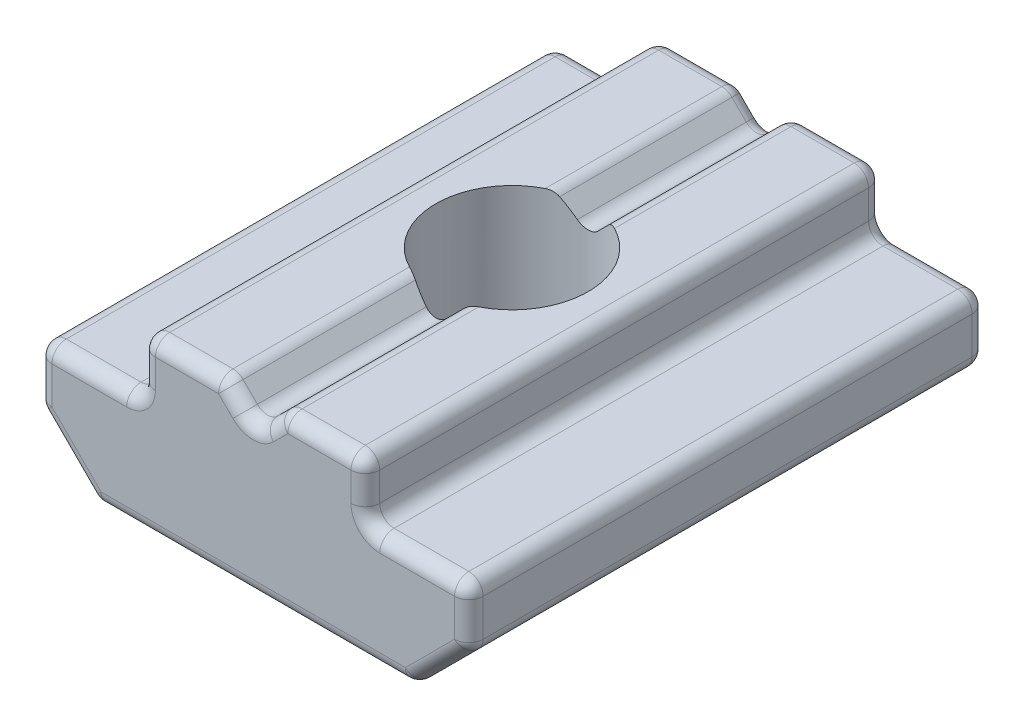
SolidWorks part; units mm, degrees
ref_plane "Спереди" through (0, 0, 0) normal (0, 0, 1) x (1, 0, 0)
ref_plane "Сверху" through (0, 0, 0) normal (0, 1, 0) x (1, 0, 0)
ref_plane "Справа" through (0, 0, 0) normal (1, 0, 0) x (0, 0, -1)
sketch "Эскиз1" plane through (0, 0, 0) normal (0, 0, 1) x (1, 0, 0)
  line L0 (-7.5, 1) -> (-7.5, -1)
  line L1 (-7.5, -1) -> (-5.5, -3)
  line L2 (-5.5, -3) -> (5.5, -3)
  line L3 (5.5, -3) -> (7.5, -1)
  line L4 (7.5, -1) -> (7.5, 1)
  line L5 (3.9, 1) -> (7.5, 1)
  line L6 (3.9, 1) -> (3.9, 3)
  line L7 (3.9, 3) -> (0.997, 3)
  line L8 (-3.9, 3) -> (-3.9, 1)
  line L9 (-3.9, 1) -> (-7.5, 1)
  line L10 (0, 3) -> (0, -3) construction
  line L11 (-7.5, 0) -> (7.5, 0) construction
  line L12 (-0.997, 3) -> (0, 2.003)
  line L13 (0.997, 3) -> (0, 2.003)
  line L14 (-0.997, 3) -> (-3.9, 3)
  dimension "D1" = 7.8
  dimension "D2" = 11
  dimension "D3" = 6
  dimension "D4" = 15
  dimension "D5" = 2
  dimension "D6" = 3.6
  dimension "D8" = 135
  dimension "D9" = 1.41
  dimension "D10" = 135
extrude "Бобышка-Вытянуть1" add sketch "Эскиз1" along normal blind 18
fillet "Скругление1" radius 0.5 39 edges at (-6.5, -2, 0) (-7.5, 0, 0) (-5.7, 1, 0) (-3.9, 2, 0) (-2.4485, 3, 0) (-0.4985, 2.5015, 0) (0.4985, 2.5015, 0) (2.4485, 3, 0) (3.9, 2, 0) (5.7, 1, 0) (7.5, 0, 0) (6.5, -2, 0) (0, -3, 0) (6.5, -2, 18) (0, -3, 18) (-6.5, -2, 18) (-7.5, 0, 18) (0.4985, 2.5015, 18) (-3.9, 2, 18) (3.9, 2, 18) (7.5, 0, 18) (5.7, 1, 18) (2.4485, 3, 18) (-0.4985, 2.5015, 18) (-2.4485, 3, 18) (-5.7, 1, 18) (-7.5, -1, 9) (-5.5, -3, 9) (5.5, -3, 9) (7.5, -1, 9) (3.9, 1, 9) (7.5, 1, 9) (3.9, 3, 9) (0.997, 3, 9) (0, 2.003, 9) (-0.997, 3, 9) (-3.9, 3, 9) (-3.9, 1, 9) (-7.5, 1, 9)
sketch "Эскиз4" plane through (0, -3, 0) normal (0, -1, 0) x (1, 0, 0)
  line L0 (0, 17.5) -> (0, 0.5) construction
  line L1 (5.2929, 17.5) -> (-5.2929, 17.5) construction
  line L2 (-5.2929, 0.5) -> (5.2929, 0.5) construction
  line L3 (-5.2929, 9) -> (5.2929, 9) construction
  line L4 (-5.2929, 17.5) -> (-5.2929, 0.5) construction
  line L5 (5.2929, 0.5) -> (5.2929, 17.5) construction
hole_wizard "Отверстие с зазором M31" positions "Эскиз2" profile "Эскиз3" hole size "M3" standard "ISO"
sketch "Эскиз2" plane through (0, -3, 0) normal (0, -1, 0) x (-1, 0, 0)
  line L8 (5.2929, -9) -> (-5.2929, -9) construction
  point P0 (0, -9)
sketch "Эскиз3" plane through (0, -3, 9) normal (1, 0, 0) x (0, 0, -1)
  line L0 (0, 0) -> (0, 6)
  line L1 (0, 6) -> (1.6, 6)
  line L2 (1.6, 6) -> (1.6, 0)
  line L5 (1.6, 0) -> (0, 0)
  line L11 (0, -6.35) -> (0, 107.95) construction
  dimension "Диаметр сквозного отверстия" = 3.2
  dimension "Глубина сквозного отверстия" = 6
hole_wizard "Отверстие с зазором M41" positions "Эскиз5" profile "Эскиз6" hole size "M4" standard "ISO"
sketch "Эскиз5" plane through (0, -3, 0) normal (0, -1, 0) x (-1, 0, 0)
  line L0 (5.2929, -9) -> (-5.2929, -9) construction
  point P0 (0, -9)
sketch "Эскиз6" plane through (0, -3, 9) normal (1, 0, 0) x (0, 0, -1)
  line L0 (0, 0) -> (0, 6)
  line L1 (0, 6) -> (2.15, 6)
  line L2 (2.15, 6) -> (2.15, 0)
  line L5 (2.15, 0) -> (0, 0)
  line L11 (0, -6.35) -> (0, 107.95) construction
  dimension "Диаметр сквозного отверстия" = 4.3
  dimension "Глубина сквозного отверстия" = 6
hole_wizard "Отверстие с зазором M51" positions "Эскиз7" profile "Эскиз8" hole size "M5" standard "ISO"
sketch "Эскиз7" plane through (0, -3, 0) normal (0, -1, 0) x (-1, 0, 0)
  line L0 (5.2929, -9) -> (-5.2929, -9) construction
  point P0 (0, -9)
sketch "Эскиз8" plane through (0, -3, 9) normal (1, 0, 0) x (0, 0, -1)
  line L0 (0, 0) -> (0, 6)
  line L1 (0, 6) -> (2.65, 6)
  line L2 (2.65, 6) -> (2.65, 0)
  line L5 (2.65, 0) -> (0, 0)
  line L11 (0, -6.35) -> (0, 107.95) construction
  dimension "Диаметр сквозного отверстия" = 5.3
  dimension "Глубина сквозного отверстия" = 6
hole_wizard "Отверстие с зазором M61" positions "Эскиз9" profile "Эскиз10" hole size "M6" standard "ISO"
sketch "Эскиз9" plane through (0, -3, 0) normal (0, -1, 0) x (-1, 0, 0)
  line L0 (0, -17.5) -> (0, -0.5) construction
  point P0 (0, -9)
sketch "Эскиз10" plane through (0, -3, 9) normal (1, 0, 0) x (0, 0, -1)
  line L0 (0, 0) -> (0, 6)
  line L1 (0, 6) -> (3.2, 6)
  line L2 (3.2, 6) -> (3.2, 0)
  line L5 (3.2, 0) -> (0, 0)
  line L11 (0, -6.35) -> (0, 107.95) construction
  dimension "Диаметр сквозного отверстия" = 6.4
  dimension "Глубина сквозного отверстия" = 6
hole_wizard "Отверстие с зазором M81" positions "Эскиз11" profile "Эскиз12" hole size "M8" standard "ISO"
sketch "Эскиз11" plane through (0, -3, 0) normal (0, -1, 0) x (-1, 0, 0)
  line L0 (0, -17.5) -> (0, -0.5) construction
  point P0 (0, -9)
sketch "Эскиз12" plane through (0, -3, 9) normal (1, 0, 0) x (0, 0, -1)
  line L0 (0, 0) -> (0, 6)
  line L1 (0, 6) -> (4.2, 6)
  line L2 (4.2, 6) -> (4.2, 0)
  line L5 (4.2, 0) -> (0, 0)
  line L11 (0, -6.35) -> (0, 107.95) construction
  dimension "Диаметр сквозного отверстия" = 8.4
  dimension "Глубина сквозного отверстия" = 6
